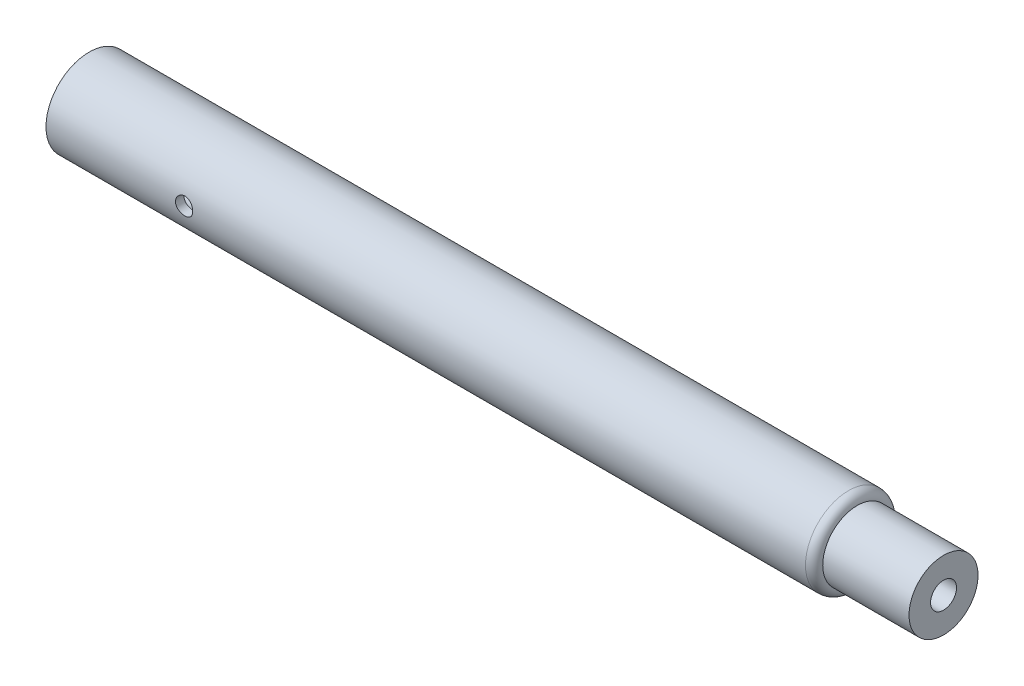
SolidWorks part; units mm, degrees
ref_plane "Plane1" through (0, 0, 0) normal (0, 0, 1) x (1, 0, 0)
ref_plane "Plane2" through (0, 0, 0) normal (0, 1, 0) x (1, 0, 0)
ref_plane "Plane3" through (0, 0, 0) normal (1, 0, 0) x (0, 0, -1)
sketch "Sketch3" plane through (0, 0, 0) normal (0, 0, 1) x (1, 0, 0)
  line L0 (0, 0) -> (199.0383, 0) construction
  line L1 (0, 6.35) -> (0, 7.9375)
  line L2 (0, 7.9375) -> (139.7127, 7.9375)
  line L3 (138.176, 0) -> (139.3952, 0)
  line L4 (141.3002, 6.35) -> (157.1752, 6.35)
  line L5 (157.1752, 6.35) -> (157.1752, 2.3876)
  line L6 (138.176, 0) -> (138.176, 4.7752)
  line L7 (138.176, 4.7752) -> (76.2, 4.7752)
  line L8 (76.2, 4.7752) -> (76.2, 6.35)
  line L9 (76.2, 6.35) -> (0, 6.35)
  line L10 (139.3952, 2.3876) -> (157.1752, 2.3876)
  line L11 (139.3952, 2.3876) -> (139.3952, 0)
  arc A0 (141.3002, 6.35) -> (139.7127, 7.9375) centre (139.7127, 6.35) ccw
  dimension "D3" = 1.5875
  dimension "D1" = 7.9375
  dimension "D2" = 6.35
  dimension "D4" = 157.1752
  dimension "D5" = 15.875
  dimension "D6" = 6.35
  dimension "D7" = 4.7752
  dimension "D8" = 157.1752
  dimension "D9" = 76.2
  dimension "D10" = 138.176
  dimension "D11" = 2.3876
  dimension "D12" = 17.78
revolve "Base-Revolve" add sketch "Sketch3" angle 360 about L0
sketch "Sketch4" plane through (157.1752, 0, 0) normal (1, 0, 0) x (0, 0, -1)
  circle A0 centre (0, 0) radius 2.3876
  dimension "D1" = 4.7752
extrude "Cut-Extrude1" cut sketch "Sketch4" against normal blind 25.4
sketch "Sketch5" plane through (0, 0, 0) normal (0, 0, 1) x (1, 0, 0)
  line L0 (157.1752, 0) -> (138.176, 0) construction
  line L1 (157.1752, 0) -> (138.176, 0) construction
  circle A0 centre (25.4, 0) radius 1.5875
  dimension "D1" = 3.175
  dimension "D2" = 25.4
extrude "Cut-Extrude2" cut sketch "Sketch5" against normal through all and the other way through all
